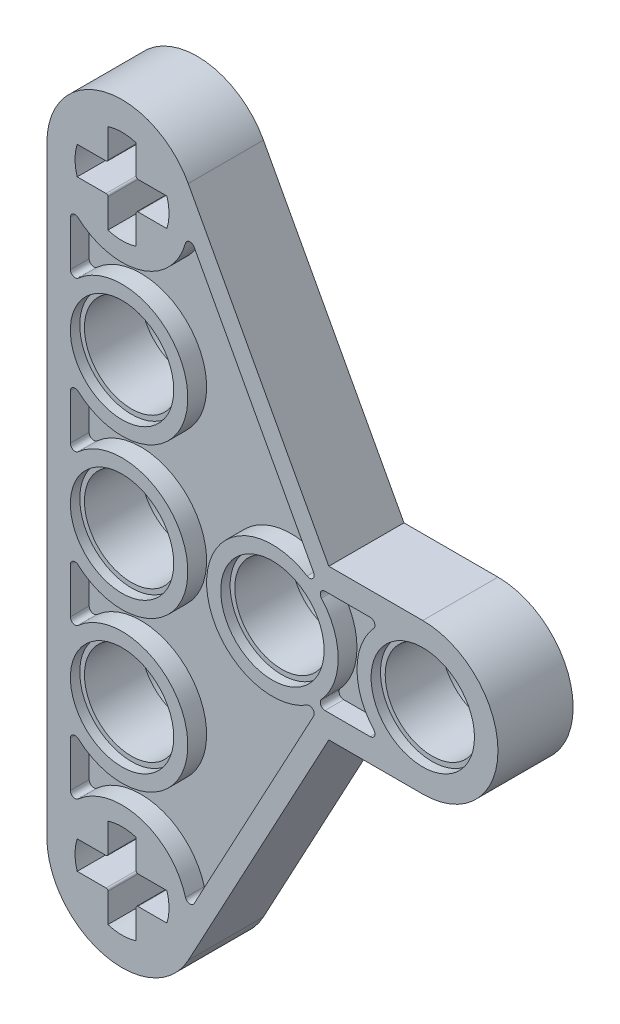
SolidWorks part; units mm, degrees
ref_plane "Alzado" through (0, 0, 0) normal (0, 0, 1) x (1, 0, 0)
ref_plane "Planta" through (0, 0, 0) normal (0, 1, 0) x (1, 0, 0)
ref_plane "Vista lateral" through (0, 0, 0) normal (1, 0, 0) x (0, 0, -1)
sketch "Croquis1" plane through (0, 0, 0) normal (0, 0, 1) x (1, 0, 0)
  line L0 (-5, 4) -> (0, 4)
  line L1 (-18.5, 16) -> (-16, 16) construction
  line L2 (-20, -16) -> (-20, 16)
  line L3 (-20, 0) -> (4, 0) construction
  line L4 (-16, 16) -> (-16, 18.1925) construction
  line L5 (-18.3848, 16.75) -> (-16.85, 16.75)
  line L6 (-16.75, 16.85) -> (-16.75, 18.3848)
  line L7 (-15.25, 16.85) -> (-15.25, 18.3848)
  line L8 (-13.6152, 16.75) -> (-15.15, 16.75)
  line L9 (-13.6152, 15.25) -> (-15.15, 15.25)
  line L10 (-15.25, 15.15) -> (-15.25, 13.6152)
  line L11 (-16.75, 15.15) -> (-16.75, 13.6152)
  line L12 (-18.3848, 15.25) -> (-16.85, 15.25)
  line L13 (-12.4776, 17.8955) -> (-5, 4)
  line L14 (-15.25, -16.85) -> (-15.25, -18.3848)
  line L15 (-16.75, -16.85) -> (-16.75, -18.3848)
  line L16 (-18.3848, -16.75) -> (-16.85, -16.75)
  line L17 (-13.6152, -16.75) -> (-15.15, -16.75)
  line L18 (-18.3848, -15.25) -> (-16.85, -15.25)
  line L19 (-16.75, -15.15) -> (-16.75, -13.6152)
  line L20 (-15.25, -15.15) -> (-15.25, -13.6152)
  line L21 (-13.6152, -15.25) -> (-15.15, -15.25)
  line L22 (-12.4776, -17.8955) -> (-5, -4)
  line L23 (-5, -4) -> (0, -4)
  arc A0 (0, -4) -> (0, 4) centre (0, 0) ccw
  arc A1 (-15.25, 18.3848) -> (-16.75, 18.3848) centre (-16, 16) ccw
  circle A2 centre (-16, 8) radius 2.5
  arc A3 (-18.5, 0) -> (-13.5, 0) centre (-16, 0) ccw
  circle A4 centre (-16, 0) radius 2.5
  circle A5 centre (-8, 0) radius 2.5
  circle A6 centre (0, 0) radius 2.5
  arc A7 (-18.3848, 16.75) -> (-18.3848, 15.25) centre (-16, 16) ccw
  arc A8 (-13.6152, 16.75) -> (-13.6152, 15.25) centre (-16, 16) cw
  arc A9 (-15.25, 13.6152) -> (-16.75, 13.6152) centre (-16, 16) cw
  arc A10 (-16.85, 16.75) -> (-16.75, 16.85) centre (-16.85, 16.85) ccw
  arc A11 (-15.25, 16.85) -> (-15.15, 16.75) centre (-15.15, 16.85) ccw
  arc A12 (-15.15, 15.25) -> (-15.25, 15.15) centre (-15.15, 15.15) ccw
  arc A13 (-16.75, 15.15) -> (-16.85, 15.25) centre (-16.85, 15.15) ccw
  arc A14 (-20, 16) -> (-12.4776, 17.8955) centre (-16, 16) cw
  arc A15 (-15.25, -18.3848) -> (-16.75, -18.3848) centre (-16, -16) cw
  arc A16 (-15.25, -16.85) -> (-15.15, -16.75) centre (-15.15, -16.85) cw
  arc A17 (-16.85, -16.75) -> (-16.75, -16.85) centre (-16.85, -16.85) cw
  arc A18 (-13.6152, -16.75) -> (-13.6152, -15.25) centre (-16, -16) ccw
  arc A19 (-18.3848, -16.75) -> (-18.3848, -15.25) centre (-16, -16) cw
  arc A20 (-16.75, -15.15) -> (-16.85, -15.25) centre (-16.85, -15.15) cw
  arc A21 (-15.15, -15.25) -> (-15.25, -15.15) centre (-15.15, -15.15) cw
  arc A22 (-15.25, -13.6152) -> (-16.75, -13.6152) centre (-16, -16) ccw
  arc A23 (-20, -16) -> (-12.4776, -17.8955) centre (-16, -16) ccw
  circle A24 centre (-16, -8) radius 2.5
  point P37 (-16.75, 16.75)
  point P40 (-15.25, 16.75)
  point P43 (-15.25, 15.25)
  point P46 (-16.75, 15.25)
  dimension "D1" = 4
  dimension "D2" = 20
  dimension "D4" = 16
  dimension "D5" = 8
  dimension "D9" = 2.5
  dimension "D3" = 8
  dimension "D13" = 0.1
  dimension "D14" = 4
  dimension "D7" = 2.5
  dimension "D8" = 8
  dimension "D6" = 16
  dimension "D10" = 1.5
  dimension "D11" = 1.5
  dimension "D15" = 5
extrude "Extruir1" add sketch "Croquis1" along normal mid plane 4
sketch "Croquis2" plane through (0, 0, 2) normal (0, 0, 1) x (1, 0, 0)
  circle A0 centre (-16, 0) radius 2.75
  circle A1 centre (-16, 0) radius 2.5 construction
  circle A2 centre (-8, 0) radius 2.75
  circle A3 centre (0, 0) radius 2.75
  circle A4 centre (-16, 8) radius 2.75
  circle A5 centre (-16, -8) radius 2.75
  dimension "D1" = 5.5
  dimension "D2" = 8
  dimension "D3" = 16
  dimension "D4" = 8
extrude "Cortar-Extruir1" cut sketch "Croquis2" against normal blind 0.5
sketch "Croquis3" plane through (0, 0, 2) normal (0, 0, 1) x (1, 0, 0)
  line L0 (-12.1641, 15.124) -> (-5.8045, 3.306)
  line L1 (-20, 0) -> (0, 0) construction
  line L2 (-20, 16) -> (-20, -16) construction
  line L3 (-5, 4) -> (-12.4776, 17.8955) construction
  line L4 (-18.75, -5.2049) -> (-18.75, -2.7951)
  line L5 (-18.75, -13.2049) -> (-18.75, -10.7951)
  line L6 (-18.75, 13.2049) -> (-18.75, 10.7951)
  line L7 (-12.1641, -15.124) -> (-5.8045, -3.306)
  line L8 (-18.75, 5.2049) -> (-18.75, 2.7951)
  line L9 (-5.2049, 2.75) -> (-2.7951, 2.75)
  line L10 (-5.2049, -2.75) -> (-2.7951, -2.75)
  arc A0 (-6.1563, 2.975) -> (-6.1563, -2.975) centre (-8, 0) ccw
  circle A1 centre (-8, 0) radius 2.75 construction
  arc A2 (-18.3333, -2.6087) -> (-18.3333, 2.6087) centre (-16, 0) ccw
  arc A3 (-18.3333, 5.3913) -> (-13.25, 5.8349) centre (-16, 8) ccw
  circle A4 centre (-16, 8) radius 2.5 construction
  circle A5 centre (-16, 0) radius 2.5 construction
  circle A6 centre (-16, 8) radius 2.75 construction
  arc A7 (-13.25, 5.8349) -> (-18.3333, 10.6087) centre (-16, 8) ccw
  arc A8 (-18.3333, 5.3913) -> (-18.75, 5.2049) centre (-18.5, 5.2049) ccw
  arc A9 (-18.3333, 2.6087) -> (-18.75, 2.7951) centre (-18.5, 2.7951) cw
  arc A10 (-18.3333, 13.3913) -> (-12.6253, 15.0718) centre (-16, 16) ccw
  arc A11 (-16.75, 13.6152) -> (-15.25, 13.6152) centre (-16, 16) ccw construction
  arc A12 (-12.6253, 15.0718) -> (-12.1641, 15.124) centre (-12.3843, 15.0055) cw
  arc A13 (-18.3333, 13.3913) -> (-18.75, 13.2049) centre (-18.5, 13.2049) ccw
  arc A14 (-18.75, 10.7951) -> (-18.3333, 10.6087) centre (-18.5, 10.7951) ccw
  arc A15 (-18.75, -10.7951) -> (-18.3333, -10.6087) centre (-18.5, -10.7951) cw
  arc A16 (-18.3333, -13.3913) -> (-18.75, -13.2049) centre (-18.5, -13.2049) cw
  arc A17 (-12.6253, -15.0718) -> (-12.1641, -15.124) centre (-12.3843, -15.0055) ccw
  arc A18 (-18.3333, -13.3913) -> (-12.6253, -15.0718) centre (-16, -16) cw
  arc A19 (-18.3333, -2.6087) -> (-18.75, -2.7951) centre (-18.5, -2.7951) ccw
  arc A20 (-18.3333, -5.3913) -> (-18.75, -5.2049) centre (-18.5, -5.2049) cw
  arc A21 (-13.25, -5.8349) -> (-18.3333, -10.6087) centre (-16, -8) cw
  arc A22 (-18.3333, -5.3913) -> (-13.25, -5.8349) centre (-16, -8) cw
  arc A23 (-6.1563, 2.975) -> (-5.8045, 3.306) centre (-6.0246, 3.1875) ccw
  arc A24 (-5.8045, -3.306) -> (-6.1563, -2.975) centre (-6.0246, -3.1875) ccw
  arc A25 (-5.3913, 2.3333) -> (-5.3913, -2.3333) centre (-8, 0) cw
  arc A26 (-2.6087, -2.3333) -> (-2.6087, 2.3333) centre (0, 0) cw
  circle A27 centre (0, 0) radius 2.75 construction
  arc A28 (-5.3913, 2.3333) -> (-5.2049, 2.75) centre (-5.2049, 2.5) cw
  arc A29 (-2.6087, 2.3333) -> (-2.7951, 2.75) centre (-2.7951, 2.5) ccw
  arc A30 (-2.6087, -2.3333) -> (-2.7951, -2.75) centre (-2.7951, -2.5) cw
  arc A31 (-5.3913, -2.3333) -> (-5.2049, -2.75) centre (-5.2049, -2.5) ccw
  point P34 (-18.75, 5.8349)
  point P61 (-4.9179, 1.6586)
  point P64 (-4.9179, -1.6586)
  dimension "D1" = 3.5
  dimension "D2" = 3.5
  dimension "D3" = 7
  dimension "D4" = 0.25
  dimension "D5" = 3.5
  dimension "D6" = 0.25
  dimension "D7" = 0.25
  dimension "D8" = 0.25
  dimension "D9" = 3.5
  dimension "D10" = 3.5
extrude "Cortar-Extruir2" cut sketch "Croquis3" against normal blind 1
mirror "Simetría1" about plane through (0, 0, 0) normal (0, 0, 1) of "Cortar-Extruir2"
mirror "Simetría2" about plane through (0, 0, 0) normal (0, 0, 1) of "Cortar-Extruir1"
